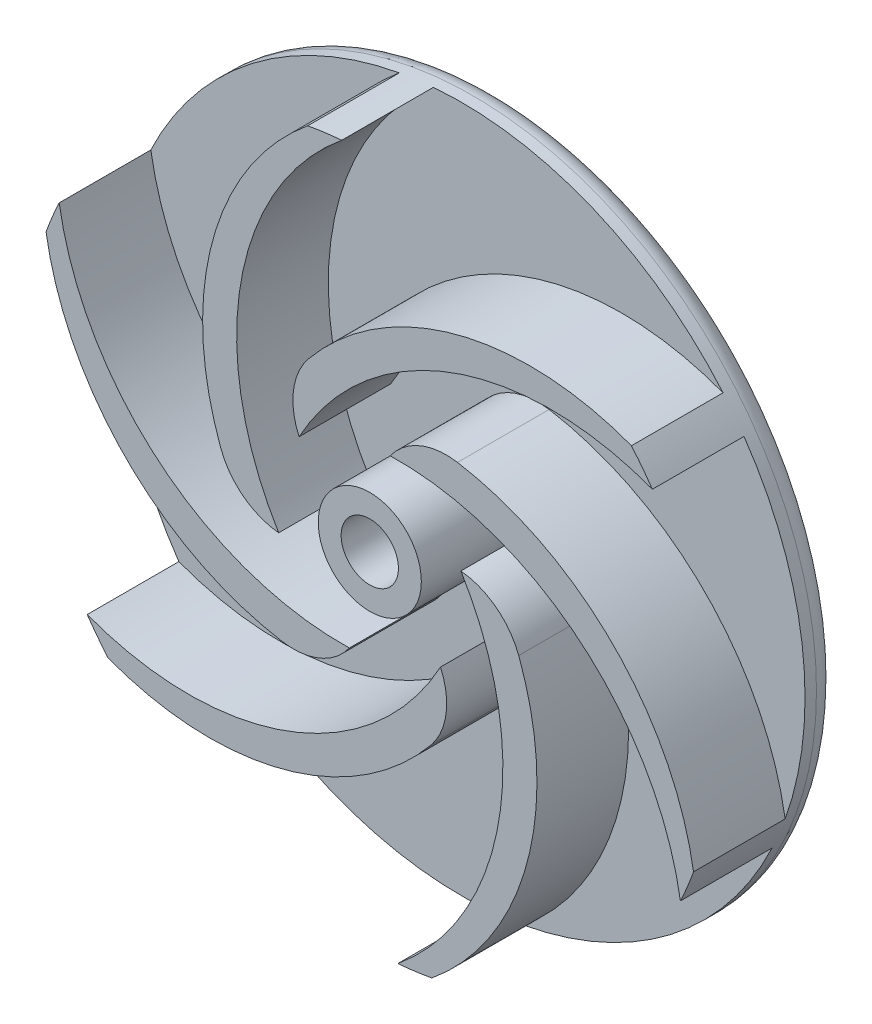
SolidWorks part; units mm, degrees
ref_plane "Alzado" through (0, 0, 0) normal (0, 0, 1) x (1, 0, 0)
ref_plane "Planta" through (0, 0, 0) normal (0, 1, 0) x (1, 0, 0)
ref_plane "Vista lateral" through (0, 0, 0) normal (1, 0, 0) x (0, 0, -1)
sketch "Croquis1" plane through (0, 0, 0) normal (0, 0, 1) x (1, 0, 0)
  circle A0 centre (0, 0) radius 15
  circle A1 centre (0, 0) radius 1.5
  dimension "D1" = 30
  dimension "D2" = 3
extrude "Saliente-Extruir1" add sketch "Croquis1" along normal blind 1.5
sketch "Croquis2" plane through (0, 0, 1.5) normal (0, 0, 1) x (1, 0, 0)
  circle A0 centre (0, 0) radius 1.25
  circle A1 centre (0, 0) radius 2.25
  dimension "D1" = 2.5
  dimension "D2" = 4.5
extrude "Saliente-Extruir2" add sketch "Croquis2" along normal blind 4
sketch "Croquis3" plane through (0, 0, 1.5) normal (0, 0, 1) x (1, 0, 0)
  line L0 (0, 0) -> (7, -2) construction
  line L1 (-4, 4) -> (-3.0859, 2.8107)
  line L2 (-4, 4) -> (0, 0) construction
  line L3 (11.4212, 9.7241) -> (12.3352, 8.5347) construction
  line L4 (7, -2) -> (7.9141, -3.1893) construction
  arc A0 (11.4212, 9.7241) -> (12.3352, 8.5347) centre (0, 0) cw
  circle A1 centre (0, 0) radius 15 construction
  arc A2 (-4, 4) -> (11.4212, 9.7241) centre (7, -2) cw
  arc A3 (-3.0859, 2.8107) -> (12.3352, 8.5347) centre (7.9141, -3.1893) cw
  dimension "D5" = 1.5
  dimension "D1" = 4
  dimension "D2" = 4
  dimension "D3" = 7
  dimension "D4" = 2
  dimension "D6" = 1.5
extrude "Saliente-Extruir3" add sketch "Croquis3" along normal blind 4
fillet "Redondeo1" radius 3 1 edges at (-4, 4, 3.5)
pattern_circular "MatrizC1" count 6 over 360 about axis through (0, 0, 0) along (0, 0, 1) of "Redondeo1", "Saliente-Extruir3"
fillet "Redondeo2" radius 1 1 edges at (15, 0, 0)
